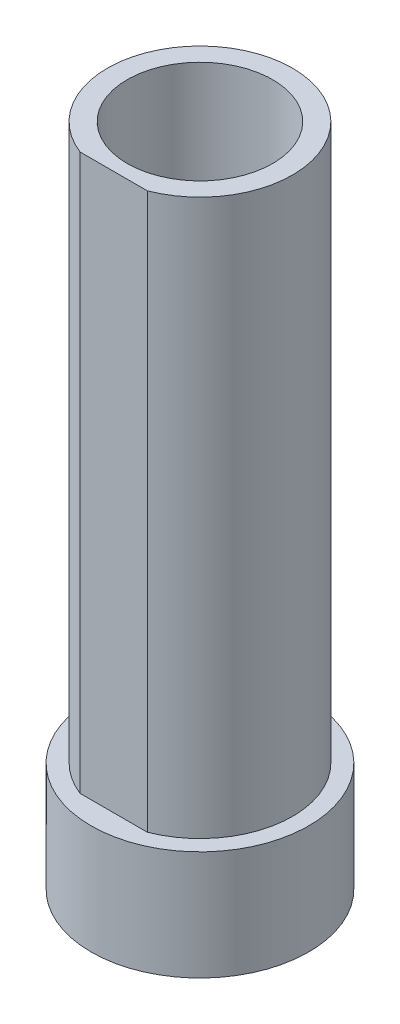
SolidWorks part; units mm, degrees
ref_plane "Front Plane" through (0, 0, 0) normal (0, 0, 1) x (1, 0, 0)
ref_plane "Top Plane" through (0, 0, 0) normal (0, 1, 0) x (1, 0, 0)
ref_plane "Right Plane" through (0, 0, 0) normal (1, 0, 0) x (0, 0, -1)
sketch "Sketch1" plane through (0, 0, 0) normal (0, 1, 0) x (1, 0, 0)
  line L0 (-3.7229, -9.55) -> (3.7229, -9.55)
  circle A0 centre (0, 0) radius 10.25
  circle A1 centre (0, 0) radius 12.05
  circle A2 centre (0, 0) radius 8.05
  point P5 (0, 10.25)
  dimension "D1" = 20.5
  dimension "D3" = 24.1
  dimension "D2" = 19.8
  dimension "D4" = 2.2
sketch "Sketch2" plane through (0, 0, 0) normal (0, 1, 0) x (1, 0, 0)
  line L0 (-3.7229, -9.55) -> (3.7229, -9.55) construction
  line L1 (-3.7229, -9.55) -> (3.7229, -9.55)
  circle A0 centre (0, 0) radius 10.25 construction
  circle A1 centre (0, 0) radius 8.05 construction
  arc A2 (3.7229, -9.55) -> (-3.7229, -9.55) centre (0, 0) ccw
  circle A3 centre (0, 0) radius 8.05
extrude "Boss-Extrude1" add sketch "Sketch2" along normal blind 61.5
sketch "Sketch3" plane through (0, 0, 0) normal (0, 1, 0) x (1, 0, 0)
  circle A0 centre (0, 0) radius 12.05 construction
  circle A1 centre (0, 0) radius 12.05
extrude "Boss-Extrude2" add sketch "Sketch3" against normal blind 12.1
sketch "Sketch5" plane through (0, 0, 0) normal (0, 0, 1) x (1, 0, 0)
  line L0 (-10.1, -12.1) -> (-1.6, -31.2)
  line L1 (-12.05, -12.1) -> (12.05, -12.1) construction
  line L2 (-1.6, -31.2) -> (0, -31.2)
  line L3 (0, -31.2) -> (0, -12.1)
  line L4 (0, -12.1) -> (-10.1, -12.1)
  line L5 (0, -31.2) -> (1.6, -31.2) construction
  line L6 (1.6, -31.2) -> (10.1, -12.1) construction
  dimension "D1" = 19.1
  dimension "D2" = 20.2
  dimension "D3" = 3.2
revolve "Revolve1" add sketch "Sketch5" angle 360 about L3
sketch "Sketch6" plane through (0, 0, 0) normal (1, 0, 0) x (0, 0, -1)
  circle A0 centre (0, -21.6003) radius 4.25
  dimension "D1" = 8.5
extrude "Boss-Extrude3" add sketch "Sketch6" along normal blind 24
